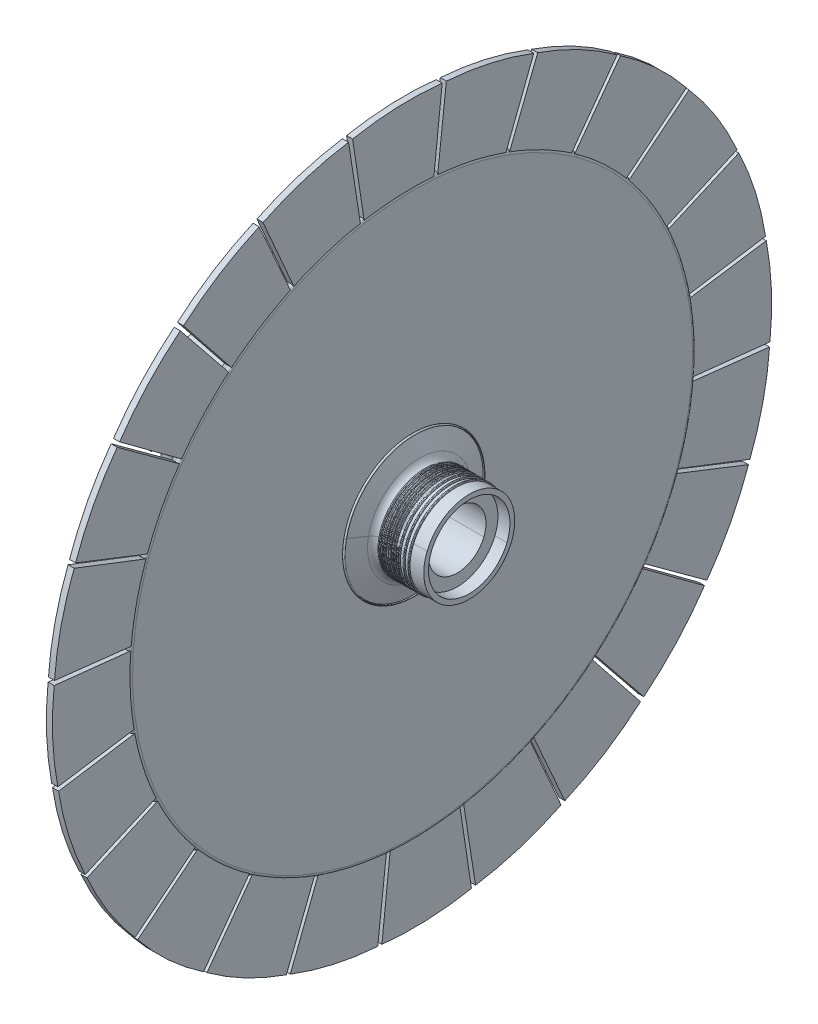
SolidWorks part; units mm, degrees
ref_plane "Alzado" through (0, 0, 0) normal (0, 0, 1) x (1, 0, 0)
ref_plane "Planta" through (0, 0, 0) normal (0, 1, 0) x (1, 0, 0)
ref_plane "Vista lateral" through (0, 0, 0) normal (1, 0, 0) x (0, 0, -1)
imported_body "A1223.IGS<1>"
delete or keep bodies "Sólido-Eliminar/Conservar 1" type delete bodies bodies 106
ref_plane "Plano1" through (70, 0, 0) normal (1, 0, 0) x (0, 0, -1)
sketch "Croquis2" plane through (70, 0, 0) normal (1, 0, 0) x (0, 0, -1)
  line L0 (13.2296, 7.5756) -> (17.139, 7.252)
  line L1 (17.139, 7.252) -> (64.4638, 129.688)
  line L2 (27.9532, 137.8808) -> (13.2296, 7.5756)
  line L3 (66.1069, 129.0851) -> (18.1596, 7.0307)
  line L4 (18.1596, 7.0307) -> (21.852, 5.7063)
  line L5 (21.852, 5.7063) -> (99.253, 111.7218)
  line L6 (100.6841, 110.7143) -> (22.7805, 5.2284)
  line L7 (22.7805, 5.2284) -> (26.0044, 2.9934)
  line L8 (26.0044, 2.9934) -> (128.2068, 85.3637)
  line L9 (129.3284, 84.0201) -> (26.7775, 2.2916)
  line L10 (26.7775, 2.2916) -> (29.3131, -0.7017)
  line L11 (29.3131, -0.7017) -> (149.3521, 52.4099)
  line L12 (150.0877, 50.8219) -> (29.8783, -1.5797)
  line L13 (29.8783, -1.5797) -> (31.5527, -5.1273)
  line L14 (31.5527, -5.1273) -> (161.2478, 15.1062)
  line L15 (161.5472, 13.3819) -> (31.8714, -6.1217)
  line L16 (31.8714, -6.1217) -> (32.5706, -9.9817)
  line L17 (32.5706, -9.9817) -> (163.0832, -24.0052)
  line L18 (162.9262, -25.7483) -> (32.621, -11.0247)
  line L19 (32.621, -11.0247) -> (32.2974, -14.9342)
  line L20 (32.2974, -14.9342) -> (154.7333, -62.259)
  line L21 (154.1305, -63.902) -> (32.0761, -15.9547)
  line L22 (32.0761, -15.9547) -> (30.7517, -19.6472)
  line L23 (30.7517, -19.6472) -> (136.7672, -97.0482)
  line L24 (135.7596, -98.4792) -> (30.2738, -20.5756)
  line L25 (30.2738, -20.5756) -> (28.0388, -23.7995)
  line L26 (28.0388, -23.7995) -> (110.4091, -126.002)
  line L27 (109.0655, -127.1235) -> (27.3369, -24.5727)
  line L28 (27.3369, -24.5727) -> (24.3437, -27.1082)
  line L29 (24.3437, -27.1082) -> (77.4553, -147.1472)
  line L30 (75.8672, -147.8828) -> (23.4656, -27.6734)
  line L31 (23.4656, -27.6734) -> (19.9181, -29.3478)
  line L32 (19.9181, -29.3478) -> (40.1516, -159.0429)
  line L33 (38.4273, -159.3424) -> (18.9237, -29.6665)
  line L34 (18.9237, -29.6665) -> (15.0637, -30.3657)
  line L35 (15.0637, -30.3657) -> (1.0402, -160.8783)
  line L36 (-0.7029, -160.7213) -> (14.0207, -30.4161)
  line L37 (14.0207, -30.4161) -> (10.1112, -30.0925)
  line L38 (10.1112, -30.0925) -> (-37.2136, -152.5285)
  line L39 (-38.8566, -151.9256) -> (9.0907, -29.8712)
  line L40 (9.0907, -29.8712) -> (5.3982, -28.5468)
  line L41 (5.3982, -28.5468) -> (-72.0028, -134.5623)
  line L42 (-73.4338, -133.5548) -> (4.4697, -28.0689)
  line L43 (4.4697, -28.0689) -> (1.2459, -25.8339)
  line L44 (1.2459, -25.8339) -> (-100.9566, -108.2042)
  line L45 (-102.0781, -106.8606) -> (0.4727, -25.1321)
  line L46 (0.4727, -25.1321) -> (-2.0628, -22.1388)
  line L47 (-2.0628, -22.1388) -> (-122.1018, -75.2504)
  line L48 (-122.8374, -73.6623) -> (-2.628, -21.2607)
  line L49 (-2.628, -21.2607) -> (-4.3025, -17.7132)
  line L50 (-4.3025, -17.7132) -> (-133.9975, -37.9467)
  line L51 (-134.297, -36.2224) -> (-4.6211, -16.7188)
  line L52 (-4.6211, -16.7188) -> (-5.3203, -12.8588)
  line L53 (-5.3203, -12.8588) -> (-135.833, 1.1647)
  line L54 (-135.6759, 2.9078) -> (-5.3708, -11.8158)
  line L55 (-5.3708, -11.8158) -> (-5.0471, -7.9063)
  line L56 (-5.0471, -7.9063) -> (-127.4831, 39.4185)
  line L57 (-126.8803, 41.0615) -> (-4.8259, -6.8858)
  line L58 (-4.8259, -6.8858) -> (-3.5014, -3.1933)
  line L59 (-3.5014, -3.1933) -> (-109.5169, 74.2077)
  line L60 (-108.5094, 75.6387) -> (-3.0236, -2.2649)
  line L61 (-3.0236, -2.2649) -> (-0.7885, 0.959)
  line L62 (-0.7885, 0.959) -> (-83.1588, 103.1615)
  line L63 (-81.8152, 104.283) -> (-0.0867, 1.7322)
  line L64 (-0.0867, 1.7322) -> (2.9066, 4.2677)
  line L65 (2.9066, 4.2677) -> (-50.205, 124.3067)
  line L66 (-48.617, 125.0423) -> (3.7846, 4.8329)
  line L67 (3.7846, 4.8329) -> (7.3321, 6.5073)
  line L68 (7.3321, 6.5073) -> (-12.9014, 136.2024)
  line L69 (-11.177, 136.5019) -> (8.3266, 6.826)
  line L70 (8.3266, 6.826) -> (12.1866, 7.5252)
  line L71 (12.1866, 7.5252) -> (26.2101, 138.0378)
  arc A1 (31.231, -18.5639) -> (-3.9808, -4.2766) centre (13.6251, -11.4202) ccw construction
  arc A2 (64.4638, 129.688) -> (27.9532, 137.8808) centre (18.7508, 11.4219) ccw
  circle A3 centre (13.6251, -11.4202) radius 19 construction
  arc A4 (99.253, 111.7218) -> (66.1069, 129.0851) centre (24.4881, 9.3169) ccw
  arc A5 (128.2068, 85.3637) -> (100.6841, 110.7143) centre (29.4852, 5.7988) ccw
  arc A6 (149.3521, 52.4099) -> (129.3284, 84.0201) centre (33.4014, 1.1072) ccw
  arc A7 (161.2478, 15.1062) -> (150.0877, 50.8219) centre (35.9699, -4.4382) ccw
  arc A8 (163.0832, -24.0052) -> (161.5472, 13.3819) centre (37.0156, -10.4593) ccw
  arc A9 (154.7333, -62.259) -> (162.9262, -25.7483) centre (36.4673, -16.5459) ccw
  arc A10 (136.7672, -97.0482) -> (154.1305, -63.902) centre (34.3623, -22.2833) ccw
  arc A11 (110.4091, -126.002) -> (135.7596, -98.4792) centre (30.8442, -27.2803) ccw
  arc A12 (77.4553, -147.1472) -> (109.0655, -127.1235) centre (26.1526, -31.1965) ccw
  arc A13 (40.1516, -159.0429) -> (75.8672, -147.8828) centre (20.6072, -33.765) ccw
  arc A14 (1.0402, -160.8783) -> (38.4273, -159.3424) centre (14.5861, -34.8107) ccw
  arc A15 (-37.2136, -152.5285) -> (-0.7029, -160.7213) centre (8.4994, -34.2624) ccw
  arc A16 (-72.0028, -134.5623) -> (-38.8566, -151.9256) centre (2.7621, -32.1574) ccw
  arc A17 (-100.9566, -108.2042) -> (-73.4338, -133.5548) centre (-2.2349, -28.6393) ccw
  arc A18 (-122.1018, -75.2504) -> (-102.0781, -106.8606) centre (-6.1511, -23.9477) ccw
  arc A19 (-133.9975, -37.9467) -> (-122.8374, -73.6623) centre (-8.7196, -18.4023) ccw
  arc A20 (-135.833, 1.1647) -> (-134.297, -36.2224) centre (-9.7653, -12.3812) ccw
  arc A21 (-127.4831, 39.4185) -> (-135.6759, 2.9078) centre (-9.217, -6.2946) ccw
  arc A22 (-109.5169, 74.2077) -> (-126.8803, 41.0615) centre (-7.1121, -0.5572) ccw
  arc A23 (-83.1588, 103.1615) -> (-108.5094, 75.6387) centre (-3.5939, 4.4398) ccw
  arc A24 (-50.205, 124.3067) -> (-81.8152, 104.283) centre (1.0977, 8.356) ccw
  arc A25 (-12.9014, 136.2024) -> (-48.617, 125.0423) centre (6.643, 10.9245) ccw
  arc A26 (26.2101, 138.0378) -> (-11.177, 136.5019) centre (12.6642, 11.9702) ccw
  spline S0 degree 2 poles (-3.9808, -4.2766) (-1.661, 1.4405) (3.575, 4.7041) (8.8141, 7.9696) (14.972, 7.532) (21.13, 7.0943) (25.8546, 3.1207) (30.5793, -0.8529) (32.066, -6.8447) (33.5527, -12.8365) (31.2335, -18.5578) knots 0 0 0 0.006663 0.006663 0.01333 0.01333 0.019996 0.019996 0.026663 0.026663 0.03333 0.03333 0.03333 weights 0.999945 0.951084 1 0.951057 1 0.951057 1 0.951057 1 0.951057 1 construction
  point P131 (13.6251, -11.4202)
  dimension "D1" = 24
extrude "Saliente-Extruir1" add sketch "Croquis2" against normal blind 2.54
